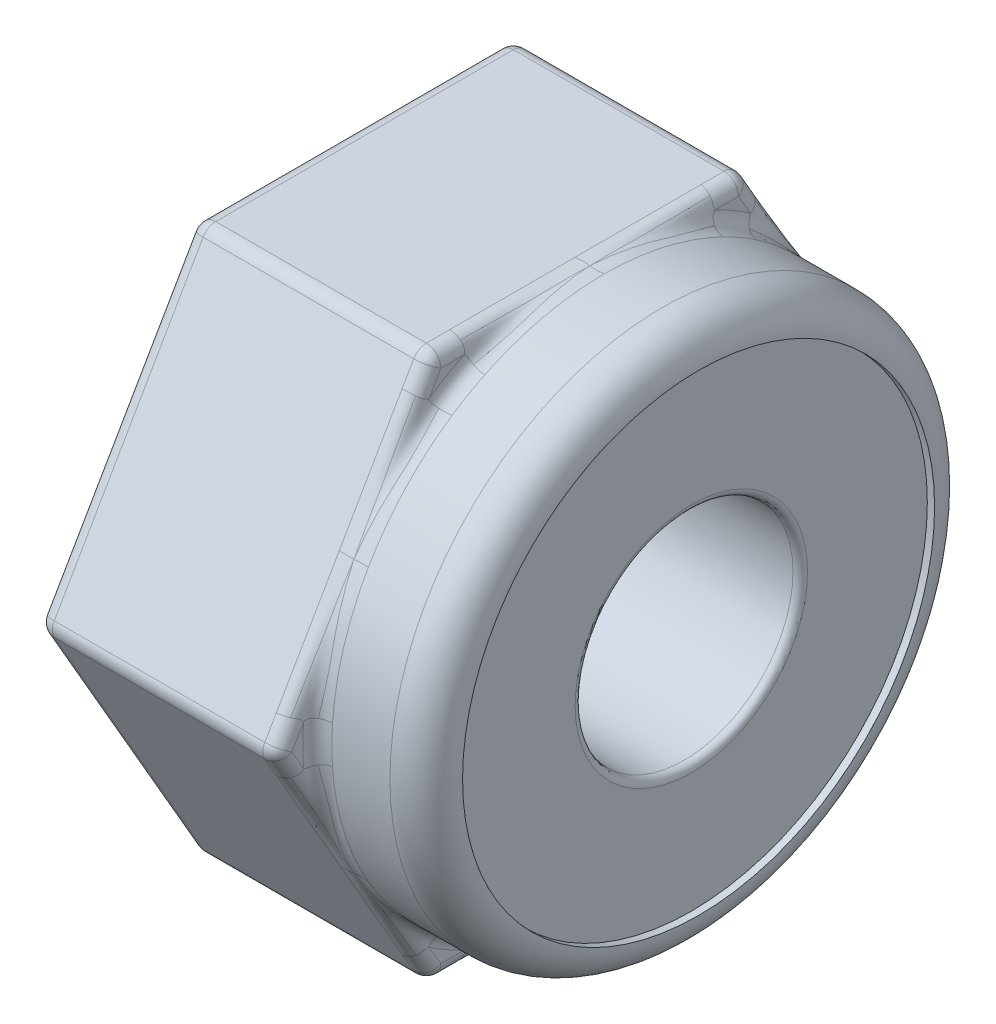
SolidWorks part; units mm, degrees
ref_plane "Front Plane" through (0, 0, 0) normal (0, 0, 1) x (1, 0, 0)
ref_plane "Top Plane" through (0, 0, 0) normal (0, 1, 0) x (1, 0, 0)
ref_plane "Right Plane" through (0, 0, 0) normal (1, 0, 0) x (0, 0, -1)
sketch "Sketch1" plane through (0, 0, 0) normal (1, 0, 0) x (0, 0, -1)
  line L1 (5.4993, 0) -> (2.7496, 4.7625)
  line L2 (2.7496, 4.7625) -> (-2.7496, 4.7625)
  line L3 (-2.7496, 4.7625) -> (-5.4993, 0)
  line L4 (-5.4993, 0) -> (-2.7496, -4.7625)
  line L5 (-2.7496, -4.7625) -> (2.7496, -4.7625)
  line L6 (2.7496, -4.7625) -> (5.4993, 0)
  circle A0 centre (0, 0) radius 4.7625 construction
  circle A1 centre (0, 0) radius 1.905
  dimension "D2" = 3.81
  dimension "D1" = 9.525
extrude "Boss-Extrude1" add sketch "Sketch1" along normal blind 4.191
sketch "Sketch2" plane through (4.191, 0, 0) normal (1, 0, 0) x (0, 0, -1)
  circle A0 centre (0, 0) radius 1.905
  circle A1 centre (0, 0) radius 4.7625
  dimension "D1" = 3.81
  dimension "D2" = 9.525
extrude "Boss-Extrude2" add sketch "Sketch2" along normal blind 1.905
fillet "Fillet1" radius 0.635 1 edges at (6.096, 0, -4.7625)
fillet "Fillet2" radius 0.254 30 edges at (4.191, 4.7625, -1.3748) (2.0955, -4.7625, -2.7496) (2.0955, -4.7625, 2.7496) (2.0955, 0, 5.4993) (2.0955, 4.7625, 2.7496) (2.0955, 4.7625, -2.7496) (2.0955, 0, -5.4993) (4.191, 3.5719, 3.437) (4.191, -1.1906, 4.8119) (4.191, -4.7625, 1.3748) (4.191, -1.1906, -4.8119) (4.191, 3.5719, -3.437) (4.191, 4.7625, 1.3748) (4.191, 1.1906, 4.8119) (4.191, -3.5719, 3.437) (4.191, -4.7625, -1.3748) (4.191, 0, -4.7625) (4.191, -4.1244, -2.3812) (4.191, -4.1244, 2.3813) (4.191, 0, 4.7625) (4.191, 4.1244, 2.3812) (4.191, 4.1244, -2.3812) (4.191, -3.5719, -3.437) (0, -4.7625, 0) (0, -2.3813, 4.1244) (0, 2.3812, 4.1244) (4.191, 1.1906, -4.8119) (0, 4.7625, 0) (0, 2.3812, -4.1244) (0, -2.3813, -4.1244)
sketch "Sketch3" plane through (6.096, 0, 0) normal (1, 0, 0) x (0, 0, -1)
  circle A0 centre (0, 0) radius 4.1275
  circle A1 centre (0, 0) radius 1.905
  dimension "D1" = 8.255
  dimension "D2" = 3.81
extrude "Cut-Extrude1" cut sketch "Sketch3" against normal blind 0.127
fillet "Fillet3" radius 0.127 1 edges at (5.969, 0, -1.905)
